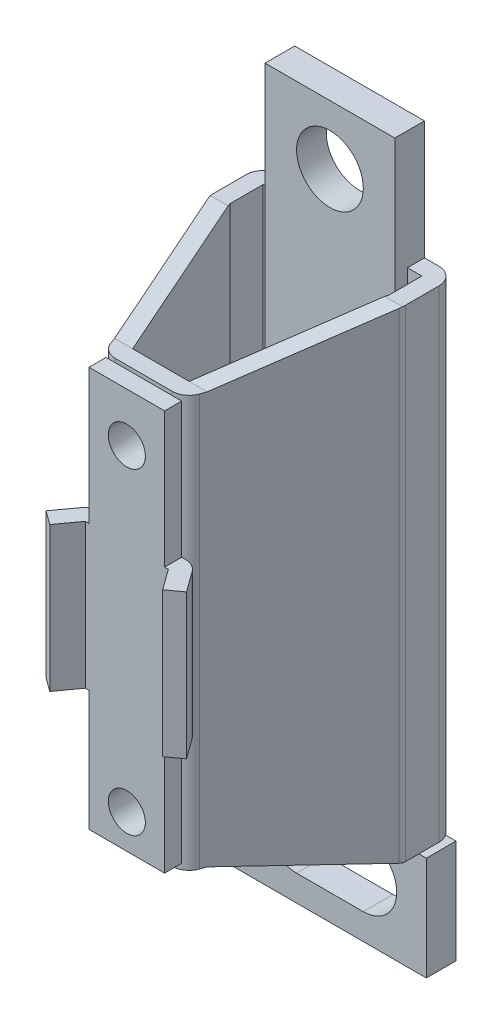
SolidWorks part; units mm, degrees
ref_plane "Front" through (0, 0, 0) normal (0, 0, 1) x (1, 0, 0)
ref_plane "Top" through (0, 0, 0) normal (0, 1, 0) x (1, 0, 0)
ref_plane "Right" through (0, 0, 0) normal (1, 0, 0) x (0, 0, -1)
sketch "Body_Sketch" plane through (0, 0, 0) normal (0, 0, 1) x (1, 0, 0)
  line L0 (0, 19.2977) -> (0, -19.0838) construction
  line L1 (-5.1, -26) -> (5.1, -26)
  line L2 (-5.1, -26) -> (-5.1, 28)
  line L3 (-5.1, 28) -> (5.1, 28)
  line L4 (5.1, -26) -> (5.1, 28)
  dimension "Height" = 54
  dimension "Loc Y" = 26
  dimension "Width" = 10.2
extrude "Body" add sketch "Body_Sketch" against normal blind 2.3
sketch "Bracket_Sketch" plane through (0, 0, 0) normal (0, 1, 0) x (1, 0, 0)
  line L0 (5.6, 0) -> (7.615, -2.7734)
  line L1 (7.615, -2.7734) -> (9.4757, -1.4215)
  line L2 (9.4757, -1.4215) -> (7.4607, 1.3519)
  line L3 (5.1, 2.3) -> (5.1, 0) construction
  line L4 (5.1, 2.3) -> (-5.1, 2.3) construction
  line L5 (0, -50) -> (0, 50) construction
  line L6 (5.6, 2.3) -> (0, 2.3)
  line L7 (0, 0) -> (0, 8.8872) construction
  line L8 (5.6, 0) -> (0, 0)
  line L9 (0, 2.3) -> (0, 0)
  arc A0 (7.4607, 1.3519) -> (5.6, 2.3) centre (5.6, 0) ccw
  point P13 (6.7719, 2.3)
  dimension "Angle" = 36
  dimension "Flat Length" = 4.6
  dimension "Inside Width" = 11.2
extrude "Bracket" add sketch "Bracket_Sketch" along normal mid plane 19.5
mirror "Bracket Mirror" about plane through (0, 0, 0) normal (1, 0, 0) of "Bracket"
sketch "Shell_Sketch" plane through (0, 0, 0) normal (0, 1, 0) x (1, 0, 0)
  line L0 (0, 0) -> (0, 19.5057) construction
  line L1 (-3.8094, 2.3) -> (3.8094, 2.3)
  line L2 (5.9841, 3.8512) -> (13, 24.2268)
  line L3 (13, 24.2268) -> (13, 31.4)
  line L4 (5.1, 2.3) -> (-5.1, 2.3) construction
  line L6 (13, 31.4) -> (-13, 31.4)
  line L7 (-13, 24.2268) -> (-13, 31.4)
  line L8 (-5.9841, 3.8512) -> (-13, 24.2268)
  arc A0 (-3.8094, 2.3) -> (-5.9841, 3.8512) centre (-3.8094, 4.6) cw
  arc A1 (5.9841, 3.8512) -> (3.8094, 2.3) centre (3.8094, 4.6) cw
  point P13 (0, 31.4)
  point P15 (0, 2.3)
  point P17 (-5.45, 2.3)
  point P20 (5.45, 2.3)
  dimension "Radius" = 2.3
  dimension "Width" = 26
  dimension "Length" = 29.1
  dimension "Front Width" = 10.9
  dimension "Angle" = 71
extrude "Shell" add sketch "Shell_Sketch" along normal blind 32 and the other way blind 33 thin
sketch "Shell Top Profile_Sketch" plane through (0, 0, 0) normal (1, 0, 0) x (0, 0, -1)
  line L0 (2.3, 28.5) -> (4.6, 28.5)
  line L1 (2.3, 32) -> (2.3, -33) construction
  line L2 (4.6, 28.5) -> (24.2268, 32)
  line L3 (24.2268, 32) -> (31.4, 32)
  line L4 (31.4, 32) -> (31.4, -33) construction
  line L5 (24.2268, 32) -> (24.2268, -33) construction
  line L6 (4.6, 32) -> (4.6, -33) construction
  line L7 (24.2268, 32) -> (31.4, 32) construction
  dimension "Width" = 3.5
extrude "Shell Top Profile" cut sketch "Shell Top Profile_Sketch" against normal through all and the other way through all
sketch "Shell Bottom Profile_Sketch" plane through (0, 0, 0) normal (1, 0, 0) x (0, 0, -1)
  line L0 (2.3, -27) -> (4.6, -27)
  line L1 (2.3, 28.5) -> (2.3, -33) construction
  line L2 (4.6, -27) -> (24.2268, -33)
  line L3 (3.8512, -33) -> (24.2268, -33) construction
  line L4 (24.2268, -33) -> (31.4, -33)
  line L5 (4.6, 28.5) -> (4.6, -33) construction
  dimension "Width" = 6
extrude "Shell Bottom Profile" cut sketch "Shell Bottom Profile_Sketch" against normal through all and the other way through all flip side to cut
fillet "Shell Rounds" radius 2.3 4 edges at (13, -0.5, -24.2268) (13, -0.5, -31.4) (-13, -0.5, -31.4) (-13, -0.5, -24.2268)
sketch "Holes_Sketch" plane through (0, 0, 0) normal (0, 0, 1) x (1, 0, 0)
  line L0 (0, 0) -> (15.1526, 0) construction
  circle A0 centre (0, 21.4) radius 2.5
  circle A1 centre (0, -21.4) radius 2.5
  dimension "Dia" = 5
  dimension "Loc Y" = 21.4
extrude "Holes" cut sketch "Holes_Sketch" against normal up to next
sketch "Boss_Sketch" plane through (0, 0, 0) normal (0, 0, -1) x (-1, 0, 0)
  circle A0 centre (0, 21.4) radius 4
  circle A2 centre (0, 21.4) radius 2.5
  circle A3 centre (0, 21.4) radius 2.5 construction
  dimension "Dia" = 8
extrude "Boss" add sketch "Boss_Sketch" along normal blind 7.5
sketch "MGT Bracket_Sketch" plane through (0, 0, -31.4) normal (0, 0, -1) x (-1, 0, 0)
  line L0 (0, 0) -> (0, 22.7536) construction
  line L1 (8.75, 48) -> (-8.75, 48)
  line L2 (8.75, 48) -> (8.75, -48)
  line L3 (8.75, -48) -> (-8.75, -48)
  line L4 (-8.75, 48) -> (-8.75, -48)
  dimension "Width" = 17.5
  dimension "C" = 48
  dimension "B" = 96
extrude "MGT Bracket" add sketch "MGT Bracket_Sketch" against normal blind 4
sketch "MGT Flange_Sketch" plane through (0, 0, -27.4) normal (0, 0, 1) x (1, 0, 0)
  line L0 (0, -15.3995) -> (0, -33.2468) construction
  line L1 (8.75, -48) -> (-8.75, -48) construction
  line L2 (-13, -48) -> (13, -48)
  line L3 (-13, -48) -> (-13, -34)
  line L4 (-13, -34) -> (13, -34)
  line L5 (13, -48) -> (13, -34)
  line L7 (-13, -33) -> (-10.7, -33) construction
  dimension "H" = 26
  dimension "Offset" = 1
extrude "MGT Flange" add sketch "MGT Flange_Sketch" along normal up to surface (4 mm away)
sketch "MGT Hole_Sketch" plane through (0, 0, -27.4) normal (0, 0, 1) x (1, 0, 0)
  circle A0 centre (0, 40) radius 4.5
  dimension "G" = 9
  dimension "E" = 40
extrude "MGT Hole" cut sketch "MGT Hole_Sketch" against normal through all
sketch "MGT Slot Top_Sketch" plane through (9.5224, -38.66, -27.4) normal (0, 0, 1) x (1, 0, 0)
  line L0 (-14.0224, -1.34) -> (-5.0224, -1.34) construction
  line L1 (-9.5224, 3.16) -> (-9.5224, -5.84) construction
  line L2 (-14.0224, 3.16) -> (-5.0224, 3.16)
  line L3 (-5.0224, -5.84) -> (-14.0224, -5.84)
  arc A0 (-5.0224, 3.16) -> (-5.0224, -5.84) centre (-5.0224, -1.34) cw
  arc A1 (-14.0224, 3.16) -> (-14.0224, -5.84) centre (-14.0224, -1.34) ccw
  circle A2 centre (-9.5224, 78.66) radius 4.5 construction
  point P12 (-9.5224, -1.34)
  dimension "F" = 18
  dimension "E" = 40
extrude "MGT Slot Top" cut sketch "MGT Slot Top_Sketch" against normal through all
sketch "MGT Slot Bottom_Sketch" [suppressed] plane through (10.0464, -46.0186, -14.5) normal (0, 0, 1) x (1, 0, 0)
  line L0 (-11.1964, 19.0186) -> (-8.8964, 19.0186) construction
  line L1 (-10.0464, 21.2686) -> (-10.0464, 16.7686) construction
  line L2 (-11.1964, 21.2686) -> (-8.8964, 21.2686)
  line L3 (-8.8964, 16.7686) -> (-11.1964, 16.7686)
  line L4 (-11.1964, 28.2686) -> (-8.8964, 28.2686) construction
  arc A0 (-8.8964, 21.2686) -> (-8.8964, 16.7686) centre (-8.8964, 19.0186) cw
  arc A1 (-11.1964, 21.2686) -> (-11.1964, 16.7686) centre (-11.1964, 19.0186) ccw
  arc A2 (-8.8964, 23.7686) -> (-8.8964, 28.2686) centre (-8.8964, 26.0186) ccw construction
  point P12 (-10.0464, 19.0186)
  dimension "EE" = 27
extrude "MGT Slot Bottom" [suppressed] cut sketch "MGT Slot Bottom_Sketch" against normal through all
